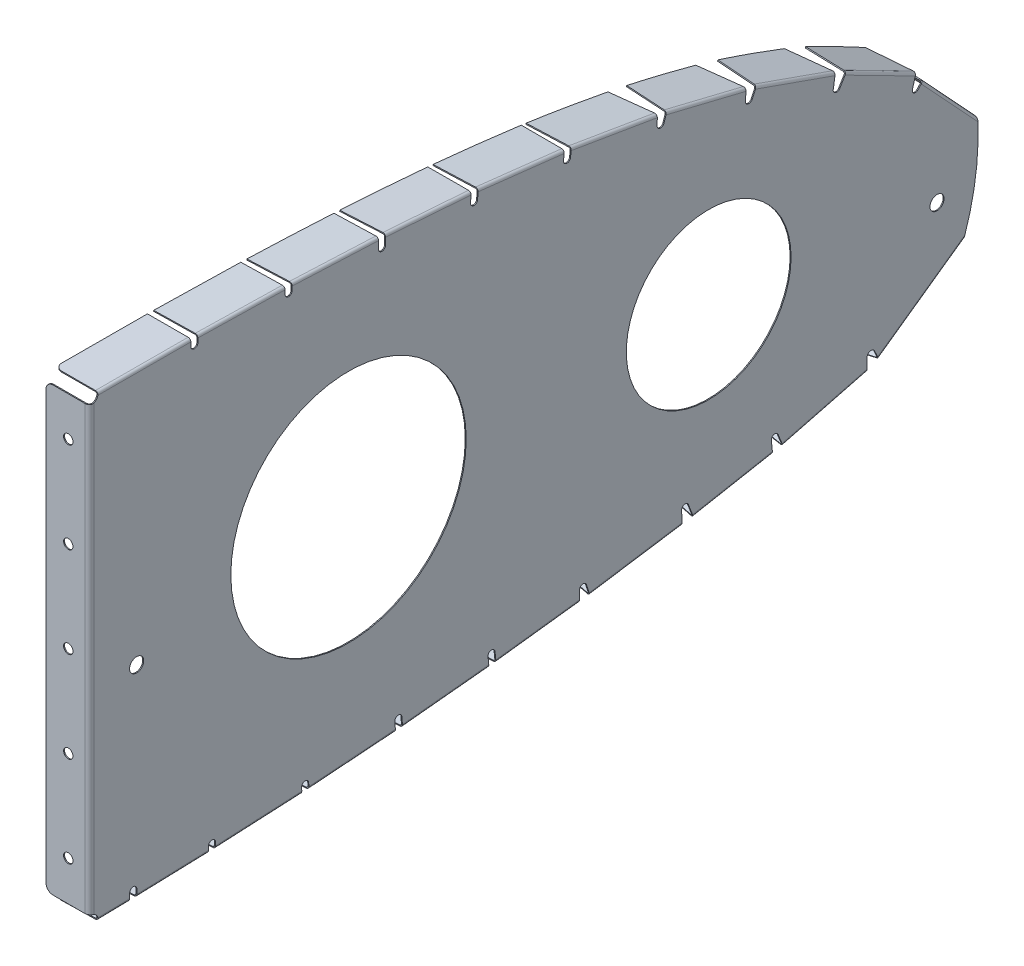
SolidWorks part; units mm, degrees
ref_plane "Ebene vorne" through (0, 0, 0) normal (0, 0, 1) x (1, 0, 0)
ref_plane "Ebene oben" through (0, 0, 0) normal (0, 1, 0) x (1, 0, 0)
ref_plane "Ebene rechts" through (0, 0, 0) normal (1, 0, 0) x (0, 0, -1)
sketch "Skizze2" plane through (0, 0, 0) normal (0, 0, 1) x (1, 0, 0)
  line B0 (356.867, 68.9287) -> (353.5801, 70.8966)
  line B1 (353.5801, 70.8966) -> (347.261, 74.4024)
  line B2 (366.0254, 63.1335) -> (359.835, 67.1517)
  line B3 (359.835, 67.1517) -> (359.4597, 67.3764)
  line B4 (359.4597, 67.3764) -> (354.4111, 56.0369)
  line B5 (370.2717, 60.1229) -> (366.0254, 63.1335)
  line B6 (351.6705, 57.2572) -> (356.867, 68.9287)
  spline B7 degree 3 poles (370.2717, 60.1229) (383.9646, 40.2709) (410.015, 2.5032) (383.0588, -33.9707) (370.2717, -51.2726) knots 0 0 0 0 0.525633 1 1 1 1
  line B8 (325.6039, 84.7176) -> (321.0227, 72.1309)
  line B9 (321.519, 86.4448) -> (314.9947, 89.0365)
  line B10 (327.9931, 83.7074) -> (325.6039, 84.7176)
  line B11 (334.4511, 80.7954) -> (327.9931, 83.7074)
  line B12 (283.8497, 99.429) -> (280.0833, 100.5257)
  line B13 (280.0833, 100.5257) -> (269.0786, 103.4571)
  line B14 (288.8547, 97.9716) -> (286.7323, 98.5897)
  line B15 (295.5026, 95.8974) -> (288.8547, 97.9716)
  line B16 (286.7323, 98.5897) -> (283.5881, 85.979)
  line B17 (247.2703, 108.4298) -> (244.8838, 94.8951)
  line B18 (241.9293, 95.416) -> (244.3335, 109.0507)
  line B19 (242.5158, 109.4349) -> (229.1565, 111.9307)
  line B20 (244.3335, 109.0507) -> (242.5158, 109.4349)
  line B21 (255.8375, 106.6186) -> (247.2703, 108.4298)
  line B22 (333.3915, -65.1198) -> (338.0123, -63.7472)
  line B23 (338.0123, -63.7472) -> (344.0098, -61.8263)
  line B24 (330.2179, -52.3913) -> (333.3915, -65.1198)
  line B25 (344.0098, -61.8263) -> (349.9866, -59.7723)
  line B26 (326.0612, -67.1791) -> (330.506, -65.9471)
  line B27 (296.5779, -74.2084) -> (308.3564, -71.6153)
  line B28 (294.3533, -74.6637) -> (296.5779, -74.2084)
  line B29 (291.4141, -75.2653) -> (288.5709, -61.8889)
  line B30 (291.5053, -61.2652) -> (294.3533, -74.6637)
  line B31 (261.4014, -80.9457) -> (273.1436, -78.8505)
  line B32 (254.3413, -82.1224) -> (261.4014, -80.9457)
  line B33 (202.7918, -89.7404) -> (211.3589, -88.5936)
  line B34 (214.5294, -88.1691) -> (226.2543, -86.5055)
  line B35 (226.2543, -86.5055) -> (237.9673, -84.7499)
  line B36 (356.0006, -57.5439) -> (362.0787, -55.0789)
  line B37 (212.6854, -74.7804) -> (214.3325, -88.1955)
  arc B38 (252.2202, -68.7303) -> (249.2571, -69.1996) centre (250.7386, -68.9649) ccw
  line B39 (280.6772, 86.7047) -> (283.8497, 99.429)
sketch_block_instance "602.10.1317.0 nose rib_11_abwicklung-1"
sketch_block "602.10.1317.0 nose rib_11_abwicklung"
sketch "Skizze1" plane through (0, 0, 0) normal (0, 0, 1) x (1, 0, 0)
  line L0 (20.0617, -82.4248) -> (20.1058, -103.2216)
  line L3 (50.411, -102.2676) -> (50.5077, -81.9871)
  line L4 (53.5077, -81.9871) -> (53.411, -102.1457)
  line L9 (90.8305, -100.3069) -> (90.095, -80.0522)
  line L10 (93.0932, -79.9475) -> (93.8261, -100.1278)
  line L16 (131.1925, -97.3956) -> (129.6961, -75.6708)
  line L17 (132.6888, -75.4615) -> (134.1815, -97.1332)
  line L22 (171.4668, -93.4466) -> (169.2537, -71.5569)
  line L23 (172.2373, -71.2433) -> (174.4483, -93.1138)
  line L28 (207.9433, -89.0508) -> (208.1729, -66.7138)
  line L29 (211.1506, -66.3482) -> (218.246, -87.6418)
  line L31 (343.0777, -40.9756) -> (349.0916, -38.7472) construction
  line L35 (252.3104, -82.4627) -> (251.5052, -58.7395)
  line L36 (254.3221, -58.0931) -> (263.001, -80.6603)
  line L41 (291.9506, -75.2653) -> (289.6419, -52.2816)
  line L42 (292.6321, -51.8972) -> (301.2444, -73.1811)
  line L48 (330.3251, -65.695) -> (330.3251, -42.0144)
  line L49 (333.4007, -41.1462) -> (343.1853, -62.0904)
  line L51 (296.5779, -74.2084) -> (308.3564, -71.6153) construction
  line L56 (368.2564, -52.2723) -> (369.3765, -51.024)
  line L57 (369.3765, 60.3715) -> (367.9476, 61.7707)
  line L58 (367.3527, 61.7707) -> (367.9476, 61.7707)
  line L59 (370.2717, 60.1229) -> (366.0254, 63.1335) construction
  line L60 (367.3527, 61.7707) -> (351.841, 45.5093)
  line L61 (349.5471, 46.8157) -> (355.9381, 69.5884)
  line L68 (330.5461, 82.5562) -> (318.8081, 62.9377)
  line L69 (315.989, 63.9637) -> (319.4081, 87.2833)
  line L76 (291.1368, 97.2596) -> (281.5388, 77.5318)
  line L77 (278.6279, 78.2576) -> (280.0833, 100.5257)
  line L82 (250.7787, 107.6881) -> (244.0729, 87.4196)
  line L83 (241.1184, 87.9406) -> (241.5115, 109.6226)
  line L88 (206.7496, 115.4862) -> (204.312, 94.4742)
  line L89 (201.3235, 94.7357) -> (203.7757, 115.9159)
  line L94 (166.3302, 120.1962) -> (164.8376, 98.7786)
  line L95 (161.8394, 98.8833) -> (163.3385, 120.4868)
  line L100 (125.9839, 123.2246) -> (125.7205, 101.5017)
  line L101 (122.7205, 101.5017) -> (122.9839, 123.4069)
  line L106 (86.0302, 125.0608) -> (86.0577, 104.654)
  line L107 (83.0577, 104.654) -> (83.0302, 125.1673)
  line L112 (46.0433, 125.9605) -> (46.0239, 105.508)
  line L113 (43.0239, 105.508) -> (43.0433, 126.0036)
  line L118 (3.635, 108.0975) -> (3.635, 123.1117)
  line L119 (0.635, 105.0975) -> (-14.365, 105.0975)
  line L120 (-17.365, 102.0975) -> (-17.365, -79.5597)
  line L121 (0.635, -82.5597) -> (-14.365, -82.5597)
  line L122 (3.635, -100.5095) -> (3.635, -85.5597)
  line L123 (17.1058, -103.2931) -> (17.0617, -82.4248)
  line L124 (353.5801, 70.8966) -> (347.261, 74.4024) construction
  line L126 (321.519, 86.4448) -> (314.9947, 89.0365) construction
  line L128 (334.4511, 80.7954) -> (327.9931, 83.7074) construction
  line L129 (295.5026, 95.8974) -> (288.8547, 97.9716) construction
  line L130 (242.5158, 109.4349) -> (229.1565, 111.9307) construction
  line L131 (255.8375, 106.6186) -> (247.2703, 108.4298) construction
  line L132 (338.0123, -63.7472) -> (344.0098, -61.8263) construction
  line L133 (261.4014, -80.9457) -> (273.1436, -78.8505) construction
  line L134 (202.7918, -89.7404) -> (211.3589, -88.5936) construction
  line L135 (214.5294, -88.1691) -> (226.2543, -86.5055) construction
  line L136 (303.6507, -52.1438) -> (315.3976, -49.2744) construction
  line L137 (269.4218, -59.1647) -> (281.144, -56.9197) construction
  line L138 (223.3298, -66.6837) -> (235.0428, -64.9281) construction
  line L139 (176.99, -72.7065) -> (188.7347, -71.315) construction
  line L140 (142.1125, -76.344) -> (153.8914, -75.2017) construction
  line L141 (103.3072, -79.478) -> (113.8012, -78.7255) construction
  line L142 (60.5219, -81.8407) -> (72.3159, -81.2952) construction
  line L143 (34.2561, 106.0866) -> (22.515, 106.1426) construction
  line L144 (69.2062, 105.5404) -> (55.9834, 105.8134) construction
  line L145 (108.4791, 104.1404) -> (95.2322, 104.7223) construction
  line L146 (147.7317, 101.7337) -> (134.4418, 102.6746) construction
  line L147 (186.9011, 97.9175) -> (173.5733, 99.4003) construction
  line L148 (225.9478, 92.2391) -> (212.5826, 94.4394) construction
  line L149 (264.474, 84.0467) -> (251.233, 87.2082) construction
  line L150 (299.9547, 73.3402) -> (289.1431, 76.9917) construction
  line L151 (338.126, 56.6739) -> (331.7485, 59.9666) construction
  circle A0 centre (-7.8955, -65.7343) radius 2
  circle A1 centre (-7.8955, 11.3387) radius 2
  circle A2 centre (-7.8955, 88.4117) radius 2
  circle A3 centre (360, 0) radius 3
  circle A4 centre (20, 0) radius 3
  circle A5 centre (110.001, 13) radius 50.0002
  circle A6 centre (263.001, 11) radius 35.0002
  circle A7 centre (-7.8955, 49.8752) radius 2
  circle A8 centre (-7.8955, -27.1978) radius 2
  arc A9 (20.0617, -82.4248) -> (17.0617, -82.4248) centre (18.5617, -82.4248) ccw
  arc A11 (53.5077, -81.9871) -> (50.5077, -81.9871) centre (52.0077, -81.9871) ccw
  arc A12 (93.0932, -79.9475) -> (90.095, -80.0522) centre (91.5941, -79.9999) ccw
  arc A13 (132.6888, -75.4615) -> (129.6961, -75.6708) centre (131.1925, -75.5661) ccw
  arc A14 (172.2373, -71.2433) -> (169.2537, -71.5569) centre (170.7455, -71.4001) ccw
  arc A15 (211.1506, -66.3482) -> (208.1729, -66.7138) centre (209.6618, -66.531) ccw
  arc A16 (254.3221, -58.0931) -> (251.5052, -58.7395) centre (253.0039, -58.8098) ccw
  arc A17 (292.6321, -51.8972) -> (289.6419, -52.2816) centre (291.137, -52.0894) ccw
  arc A18 (333.4007, -41.1462) -> (330.3251, -42.0144) centre (331.9733, -41.9714) ccw
  arc A19 (349.5471, 46.8157) -> (351.841, 45.5093) centre (350.8567, 46.4482) ccw
  arc A20 (315.989, 63.9637) -> (318.8081, 62.9377) centre (317.3986, 63.4507) ccw
  arc A21 (278.6279, 78.2576) -> (281.5388, 77.5318) centre (280.0833, 77.8947) ccw
  arc A22 (241.1184, 87.9406) -> (244.0729, 87.4196) centre (242.5957, 87.6801) ccw
  arc A23 (201.3235, 94.7357) -> (204.312, 94.4742) centre (202.8177, 94.6049) ccw
  arc A24 (161.8394, 98.8833) -> (164.8376, 98.7786) centre (163.3385, 98.8309) ccw
  arc A25 (122.7205, 101.5017) -> (125.7205, 101.5017) centre (124.2205, 101.5017) ccw
  arc A26 (83.0577, 104.654) -> (86.0577, 104.654) centre (84.5577, 104.654) ccw
  arc A27 (43.0239, 105.508) -> (46.0239, 105.508) centre (44.5239, 105.508) ccw
  arc A28 (6.623, 126.1117) -> (3.635, 123.1117) centre (6.635, 123.1117) ccw
  arc A29 (0.635, 105.0975) -> (3.635, 108.0975) centre (0.635, 108.0975) ccw
  arc A30 (-14.365, 105.0975) -> (-17.365, 102.0975) centre (-14.365, 102.0975) ccw
  arc A31 (-17.365, -79.5597) -> (-14.365, -82.5597) centre (-14.365, -79.5597) ccw
  arc A32 (3.635, -85.5597) -> (0.635, -82.5597) centre (0.635, -85.5597) ccw
  arc A33 (3.635, -100.5095) -> (6.6899, -103.509) centre (6.635, -100.5095) ccw
  arc A34 (6.6899, -103.509) -> (17.1058, -103.2931) centre (-32.8056, 2053.7087) ccw
  arc A35 (19.6154, -83.2276) -> (37.2473, -82.7223) centre (-32.8056, 2053.7087) ccw construction
  spline S0 degree 3 poles (369.3765, 60.3715) (383.0694, 40.5196) (409.1198, 2.7518) (382.1636, -33.722) (369.3765, -51.024) knots 0 0 0 0 0.525633 1 1 1 1
  spline S1 degree 2 poles (6.623, 126.1117) (24.8336, 126.2059) (43.0433, 126.0036) knots 0 0 0 1 1 1
  spline S2 degree 2 poles (46.0433, 125.9605) (64.5401, 125.7182) (83.0302, 125.1673) knots 0 0 0 1 1 1
  spline S3 degree 2 poles (86.0302, 125.0608) (104.516, 124.4341) (122.9839, 123.4069) knots 0 0 0 1 1 1
  spline S4 degree 2 poles (125.9839, 123.2246) (144.6824, 122.1451) (163.3385, 120.4868) knots 0 0 0 1 1 1
  spline S5 degree 2 poles (166.3302, 120.1962) (185.096, 118.4323) (203.7757, 115.9159) knots 0 0 0 1 1 1
  spline S6 degree 2 poles (206.7496, 115.4862) (224.2136, 113.047) (241.5115, 109.6226) knots 0 0 0 1 1 1
  spline S7 degree 2 poles (250.7787, 107.6881) (265.5573, 104.6237) (280.0833, 100.5257) knots 0 0 0 1 1 1
  spline S8 degree 2 poles (291.1368, 97.2596) (305.5137, 92.9552) (319.4081, 87.2833) knots 0 0 0 1 1 1
  spline S9 degree 2 poles (330.5461, 82.5562) (343.6208, 76.8138) (355.9381, 69.5884) knots 0 0 0 1 1 1
  spline S10 degree 2 poles (20.1058, -103.2216) (35.2617, -102.8494) (50.411, -102.2676) knots 0 0 0 1 1 1
  spline S11 degree 2 poles (53.411, -102.1457) (72.1305, -101.4245) (90.8305, -100.3069) knots 0 0 0 1 1 1
  spline S12 degree 2 poles (93.8261, -100.1278) (112.525, -98.9762) (131.1925, -97.3956) knots 0 0 0 1 1 1
  spline S13 degree 2 poles (174.4483, -93.1138) (191.2151, -91.2408) (207.9433, -89.0508) knots 0 0 0 1 1 1
  spline S14 degree 2 poles (134.1815, -97.1332) (152.8451, -95.5016) (171.4668, -93.4466) knots 0 0 0 1 1 1
  spline S15 degree 2 poles (218.246, -87.6418) (235.2972, -85.1772) (252.3104, -82.4627) knots 0 0 0 1 1 1
  spline S16 degree 2 poles (263.001, -80.6603) (277.4841, -78.007) (291.9506, -75.2653) knots 0 0 0 1 1 1
  spline S17 degree 2 poles (301.2444, -73.1811) (315.9445, -70.0586) (330.3251, -65.695) knots 0 0 0 1 1 1
  spline S18 degree 2 poles (343.1853, -62.0904) (356.0273, -57.964) (368.2564, -52.2723) knots 0 0 0 1 1 1
sheet metal parameters "Sheet-Metal1" thickness 0.41 parameters "D1"=0.7366
base flange "Base-Flange1" sketch "Skizze1" thickness 0.41 reverse thickness direction yes parameters "D1"=0.7366
sketch "Sketch3" plane through (0, 0, 0) normal (0, 0, -1) x (-1, 0, 0)
  line L0 (-367.3527, 61.7707) -> (-365.9563, 70.3982)
  line L1 (-365.9563, 70.3982) -> (-422.2889, 7.0668)
  line L2 (-422.2889, 7.0668) -> (-365.9563, -76.3382)
  line L3 (-365.9563, -76.3382) -> (-338.1075, -76.3382)
  line L4 (-338.1075, -76.3382) -> (-343.1853, -62.0904)
  arc A0 (-367.3527, 61.7707) -> (-343.1853, -62.0904) centre (-270.4691, 16.3861) ccw
extrude "Cut-Extrude1" cut sketch "Sketch3" against normal blind 10
sketch "Sketch2" plane through (0, 0, 0) normal (0, 0, 1) x (1, 0, 0)
  line L0 (0.635, 121.3707) -> (0.635, -115.3196)
  line L1 (-17.365, 102.0975) -> (-17.365, -79.5597) construction
  dimension "D1" = 18
sketched bend "Sketched Bend1" parameters "D1"=1.5
bend "SketchBend1" bend radius 1.5 bend angle 90 parameters "D5"=1
sketch "Skizze3" plane through (0.7959, 0, 0) normal (-1, 0, 0) x (0, 0, 1)
  line L212 (-366.8786, 61.7707) -> (-351.3668, 45.5093) construction
  line L213 (-332.9266, -41.1462) -> (-342.7112, -62.0904) construction
  arc A2 (-6.242, 108.112) -> (-42.3693, 108.0047) centre (-17.7173, -2111.0122) ccw
  arc A3 (-6.242, 108.112) -> (-42.3693, 108.0047) centre (-17.7173, -2111.0122) ccw
  arc A5 (-45.3336, 107.962) -> (-82.0199, 107.1752) centre (-16.5565, -2089.6277) ccw
  arc A6 (-45.3336, 107.962) -> (-82.0199, 107.1752) centre (-16.5565, -2089.6277) ccw
  arc A8 (-84.9463, 107.0711) -> (-121.5101, 105.4347) centre (-27.7518, -1580.1419) ccw
  arc A9 (-84.9463, 107.0711) -> (-121.5101, 105.4347) centre (-27.7518, -1580.1419) ccw
  arc A11 (-124.4725, 105.2545) -> (-161.2707, 102.5575) centre (-55.8633, -1083.2736) ccw
  arc A12 (-124.4725, 105.2545) -> (-161.2707, 102.5575) centre (-55.8633, -1083.2736) ccw
  arc A14 (-164.1716, 102.2752) -> (-200.8986, 98.0771) centre (-78.0769, -813.6691) ccw
  arc A15 (-164.1716, 102.2752) -> (-200.8986, 98.0771) centre (-78.0769, -813.6691) ccw
  arc A161 (-16.2153, -85.2979) -> (-5.8863, -85.512) centre (33.2797, 2053.7087) ccw
  arc A162 (-16.2153, -85.2979) -> (-5.8863, -85.512) centre (33.2797, 2053.7087) ccw
  arc A164 (-49.2461, -84.2808) -> (-19.1898, -85.2271) centre (34.1931, 2088.3133) ccw
  arc A165 (-49.2461, -84.2808) -> (-19.1898, -85.2271) centre (34.1931, 2088.3133) ccw
  arc A167 (-89.2826, -82.3389) -> (-52.2438, -84.1591) centre (15.1551, 1665.1436) ccw
  arc A168 (-89.2826, -82.3389) -> (-52.2438, -84.1591) centre (15.1551, 1665.1436) ccw
  arc A170 (-129.1998, -79.4598) -> (-92.2455, -82.1618) centre (6.9609, 1528.6933) ccw
  arc A171 (-129.1998, -79.4598) -> (-92.2455, -82.1618) centre (6.9609, 1528.6933) ccw
  arc A173 (-169.0182, -75.5552) -> (-132.1397, -79.2016) centre (9.95, 1546.1403) ccw
  arc A174 (-169.0182, -75.5552) -> (-132.1397, -79.2016) centre (9.95, 1546.1403) ccw
  arc A176 (-205.1326, -71.2031) -> (-171.9759, -75.2251) centre (23.927, 1678.4342) ccw
  arc A177 (-205.1326, -71.2031) -> (-171.9759, -75.2251) centre (23.927, 1678.4342) ccw
  arc A215 (-249.0002, -64.6876) -> (-215.197, -69.8269) centre (118.088, 2236.0364) ccw
  arc A216 (-249.0002, -64.6876) -> (-215.197, -69.8269) centre (118.088, 2236.0364) ccw
  arc A218 (-288.1247, -57.5801) -> (-259.2833, -62.955) centre (605.3102, 4656.5029) ccw
  arc A219 (-288.1247, -57.5801) -> (-259.2833, -62.955) centre (605.3102, 4656.5029) ccw
  arc A220 (-366.8786, 61.7707) -> (-342.7112, -62.0904) centre (-269.995, 16.3861) ccw construction
  spline S0 degree 3 poles (-1930.9065, -3431.7277) (-738.4809, 1087.146) (-57.0103, 1202.0975) (2551.7431, -2675.5924) knots -56.869241 -56.869241 -56.869241 -56.869241 57.869206 57.869206 57.869206 57.869206 only from (-237.5418, 91.9652) to (-203.7856, 97.6592)
  spline S1 degree 3 poles (-237.5418, 91.9652) (-226.3433, 94.1822) (-215.0917, 96.0801) (-203.7856, 97.6592) knots 0 0 0 0 1 1 1 1
  spline S2 degree 3 poles (-1633.135, -3623.6823) (-492.0964, 1155.3841) (-548.3441, 1141.6322) (2668.4969, -2572.3238) knots -56.213679 -56.213679 -56.213679 -56.213679 57.213786 57.213786 57.213786 57.213786 only from (-274.7219, 83.2019) to (-246.65, 90.063)
  spline S3 degree 3 poles (-274.7219, 83.2019) (-265.4448, 85.8191) (-256.0885, 88.1059) (-246.65, 90.063) knots 0 0 0 0 1 1 1 1
  spline S4 degree 3 poles (-1403.1224, -3754.4284) (-205.1733, 1255.5433) (-1112.4282, 935.3811) (2964.5208, -2213.2213) knots -48.229815 -48.229815 -48.229815 -48.229815 49.230075 49.230075 49.230075 49.230075 only from (-312.1311, 70.6183) to (-285.5, 80.0159)
  spline S5 degree 3 poles (-312.1311, 70.6183) (-303.4043, 74.1808) (-294.5299, 77.3124) (-285.5, 80.0159) knots 0 0 0 0 1 1 1 1
  spline S6 degree 3 poles (-1131.3529, -3859.8893) (-1.5455, 1401.7411) (-1616.7679, 576.8482) (3308.1064, -1592.5887) knots -44.530747 -44.530747 -44.530747 -44.530747 45.530507 45.530507 45.530507 45.530507 only from (-346.3564, 54.0625) to (-322.8337, 66.0757)
  spline S7 degree 3 poles (-346.3564, 54.0625) (-338.7473, 58.5261) (-330.9107, 62.5283) (-322.8337, 66.0757) knots 0 0 0 0 1 1 1 1
  spline S8 degree 3 poles (2690.7043, 2554.1506) (-860.2284, -1037.2632) (-305.4355, -1180.1072) (-1680.8678, 3679.409) knots -51.372088 -51.372088 -51.372088 -51.372088 52.371449 52.371449 52.371449 52.371449 only from (-297.0304, -55.5739) to (-324.6244, -48.4705)
  spline S9 degree 3 poles (-297.0304, -55.5739) (-306.3304, -53.5985) (-315.5266, -51.2312) (-324.6244, -48.4705) knots 0 0 0 0 1 1 1 1
  spline S10 degree 2 poles (-353.3372, 47.5749) (-365.4604, 35.9305) (-376.2, 22.9044) knots 0.220779 0.220779 0.220779 1 1 1
  spline S11 degree 2 poles (-334.6253, -44.7824) (-355.0026, -36.0717) (-370.9645, -18.9884) knots 0.193025 0.193025 0.193025 1 1 1
  dimension "D1" = 18
  dimension "D2" = 18
  dimension "D3" = 18
  dimension "D4" = 18
  dimension "D5" = 18
  dimension "D6" = 18
  dimension "D7" = 18
  dimension "D8" = 18
  dimension "D9" = 18
  dimension "D10" = 18
  dimension "D11" = 18
  dimension "D12" = 18
  dimension "D13" = 18
  dimension "D14" = 18
  dimension "D15" = 18
  dimension "D16" = 18
  dimension "D17" = 18
  dimension "D18" = 18
sketch "Skizze4" plane through (0.7959, 0, 0) normal (-1, 0, 0) x (0, 0, 1)
  line L1 (-346.3564, 54.0625) -> (-322.8337, 66.0757)
  line L2 (-376.2, 22.9044) -> (-353.3372, 47.5749)
  line L3 (-312.1311, 70.6183) -> (-285.5, 80.0159)
  line L4 (-274.7219, 83.2019) -> (-246.65, 90.063)
  line L5 (-237.5418, 91.9652) -> (-203.7856, 97.6592)
  line L6 (-200.8986, 98.0771) -> (-164.1716, 102.2752)
  line L7 (-161.2707, 102.5575) -> (-124.4725, 105.2545)
  line L8 (-121.5101, 105.4347) -> (-84.9463, 107.0711)
  line L9 (-82.0199, 107.1752) -> (-45.3336, 107.962)
  line L10 (-42.3693, 108.0047) -> (-6.242, 108.112)
  line L11 (-334.6253, -44.7824) -> (-370.9645, -18.9884)
  line L12 (-324.6244, -48.4705) -> (-297.0304, -55.5739)
  line L13 (-288.1247, -57.5801) -> (-259.2833, -62.955)
  line L14 (-249.0002, -64.6876) -> (-215.197, -69.8269)
  line L15 (-205.1326, -71.2031) -> (-171.9759, -75.2251)
  line L16 (-169.0182, -75.5552) -> (-132.1397, -79.2016)
  line L17 (-129.1998, -79.4598) -> (-92.2455, -82.1618)
  line L18 (-89.2826, -82.3389) -> (-52.2438, -84.1591)
  line L19 (-49.2461, -84.2808) -> (-19.1898, -85.2271)
  line L20 (-16.2153, -85.2979) -> (-5.8863, -85.512)
sketched bend "Skizzierte Biegung2" parameters "D1"=0
bend "Skizzenbiegung3" bend radius 0.7366 bend angle 90 parameters "D5"=2
bend "Skizzenbiegung4" bend radius 0 bend angle 90 parameters "D5"=3
bend "Skizzenbiegung5" bend radius 0 bend angle 90 parameters "D5"=4
bend "Skizzenbiegung6" bend radius 0 bend angle 90 parameters "D5"=5
bend "Skizzenbiegung7" bend radius 0 bend angle 90 parameters "D5"=6
bend "Skizzenbiegung8" bend radius 0 bend angle 90 parameters "D5"=7
bend "Skizzenbiegung9" bend radius 0 bend angle 90 parameters "D5"=8
bend "Skizzenbiegung10" bend radius 0 bend angle 90 parameters "D5"=9
bend "Skizzenbiegung11" bend radius 0 bend angle 90 parameters "D5"=10
bend "Skizzenbiegung12" bend radius 0 bend angle 90 parameters "D5"=11
bend "Skizzenbiegung13" bend radius 0 bend angle 90 parameters "D5"=22
bend "Skizzenbiegung14" bend radius 0 bend angle 90 parameters "D5"=23
bend "Skizzenbiegung15" bend radius 0 bend angle 90 parameters "D5"=24
bend "Skizzenbiegung16" bend radius 0 bend angle 90 parameters "D5"=25
bend "Skizzenbiegung17" bend radius 0 bend angle 90 parameters "D5"=26
bend "Skizzenbiegung18" bend radius 0 bend angle 90 parameters "D5"=27
bend "Skizzenbiegung19" bend radius 0 bend angle 90 parameters "D5"=28
bend "Skizzenbiegung20" bend radius 0 bend angle 90 parameters "D5"=29
bend "Skizzenbiegung21" bend radius 0 bend angle 90 parameters "D5"=30
bend "Skizzenbiegung22" bend radius 0 bend angle 90 parameters "D5"=31
flat pattern "Flat-Pattern1"
sketch "Bend-Lines1" plane through (1.2059, 0, 0) normal (1, 0, 0) x (0, 0, -1)
  line L6 (0.1609, -82.5597) -> (0.1609, 105.0975) construction
  line L20 (0.1609, -82.5597) -> (0.1609, 105.0975) construction
bend of the flat pattern "Flatten-<SketchBend1>1"
bend of the flat pattern "Abwickeln-<Skizzenbiegung3>1"
bend of the flat pattern "Abwickeln-<Skizzenbiegung4>1"
bend of the flat pattern "Abwickeln-<Skizzenbiegung5>1"
bend of the flat pattern "Abwickeln-<Skizzenbiegung6>1"
bend of the flat pattern "Abwickeln-<Skizzenbiegung7>1"
bend of the flat pattern "Abwickeln-<Skizzenbiegung8>1"
bend of the flat pattern "Abwickeln-<Skizzenbiegung9>1"
bend of the flat pattern "Abwickeln-<Skizzenbiegung10>1"
bend of the flat pattern "Abwickeln-<Skizzenbiegung11>1"
bend of the flat pattern "Abwickeln-<Skizzenbiegung12>1"
bend of the flat pattern "Abwickeln-<Skizzenbiegung13>1"
bend of the flat pattern "Abwickeln-<Skizzenbiegung14>1"
bend of the flat pattern "Abwickeln-<Skizzenbiegung15>1"
bend of the flat pattern "Abwickeln-<Skizzenbiegung16>1"
bend of the flat pattern "Abwickeln-<Skizzenbiegung17>1"
bend of the flat pattern "Abwickeln-<Skizzenbiegung18>1"
bend of the flat pattern "Abwickeln-<Skizzenbiegung19>1"
bend of the flat pattern "Abwickeln-<Skizzenbiegung20>1"
bend of the flat pattern "Abwickeln-<Skizzenbiegung21>1"
bend of the flat pattern "Abwickeln-<Skizzenbiegung22>1"
